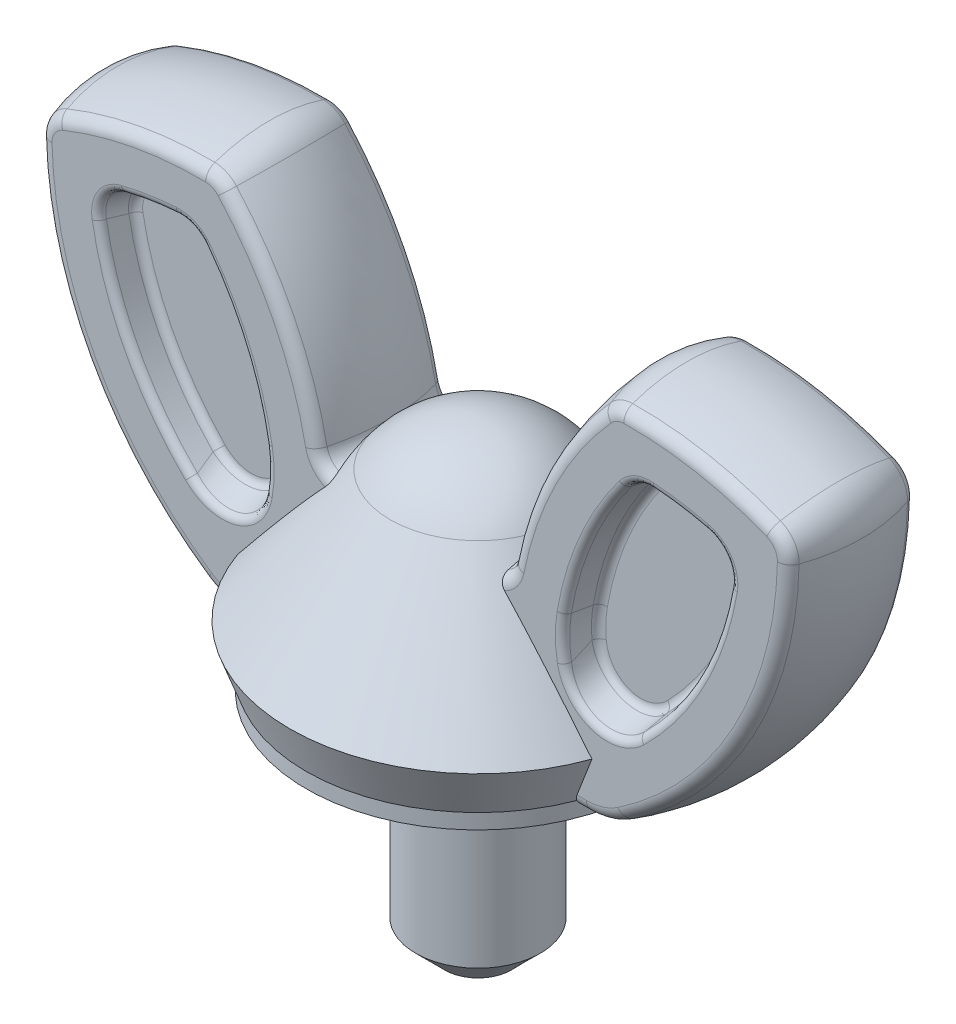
SolidWorks part; units mm, degrees
ref_plane "Front Plane" through (0, 0, 0) normal (0, 0, 1) x (1, 0, 0)
ref_plane "Top Plane" through (0, 0, 0) normal (0, 1, 0) x (1, 0, 0)
ref_plane "Right Plane" through (0, 0, 0) normal (1, 0, 0) x (0, 0, -1)
other "Configuration Table"
sketch "Sketch1" plane through (0, 0, 0) normal (0, 0, 1) x (1, 0, 0)
  line L0 (0, 10.7344) -> (0, 0) construction
  line L5 (4.826, 0) -> (-4.826, 0)
  line L6 (2.413, 5.08) -> (-2.413, 5.08)
  arc A11 (-2.413, 5.08) -> (-5.3975, 10.9034) centre (-13.1787, 3.2391) ccw
  arc A13 (-5.3975, 10.9034) -> (-10.795, 9.8298) centre (-6.0342, 0) ccw
  arc A24 (-10.795, 9.8298) -> (-6.0486, 0.3742) centre (0, 9.3295) ccw
  arc A26 (-4.826, 0) -> (-6.0486, 0.3742) centre (-4.826, 2.1844) cw
  arc A29 (4.826, 0) -> (6.0486, 0.3742) centre (4.826, 2.1844) ccw
  arc A34 (10.795, 9.8298) -> (6.0486, 0.3742) centre (0, 9.3295) cw
  arc A36 (5.3975, 10.9034) -> (10.795, 9.8298) centre (6.0342, 0) cw
  arc A37 (2.413, 5.08) -> (5.3975, 10.9034) centre (13.1787, 3.2391) cw
  point P19 (0, 0)
  point P27 (0, 5.08)
  point P29 (0, 5.08)
  point P44 (0, 5.08)
extrude "Extrude1" add sketch "Sketch1" along normal mid plane 3.556
fillet "Fillet4" radius 1.0922 4 edges at (10.795, 9.8298, 0) (5.3975, 10.9034, 0) (-5.3975, 10.9034, 0) (-10.795, 9.8298, 0)
sketch "Sketch2" plane through (0, 0, 1.778) normal (0, 0, 1) x (1, 0, 0)
  line L0 (0, 0) -> (0, 12.8329) construction
  line L1 (-4.826, 0) -> (4.826, 0) construction
  arc A10 (-4.1864, 4.7767) -> (-5.0416, 1.8652) centre (-7.5893, 4.1949) cw
  arc A11 (4.1864, 4.7767) -> (6.2055, 9.1212) centre (13.1787, 3.2391) cw
  arc A12 (6.2055, 9.1212) -> (8.9805, 8.634) centre (6.0342, 0) cw
  arc A13 (8.9805, 8.634) -> (5.0416, 1.8652) centre (0, 9.3295) cw
  arc A14 (4.1864, 4.7767) -> (5.0416, 1.8652) centre (7.5893, 4.1949) ccw
  arc A15 (-8.9805, 8.634) -> (-5.0416, 1.8652) centre (0, 9.3295) ccw
  arc A16 (-6.2055, 9.1212) -> (-8.9805, 8.634) centre (-6.0342, 0) ccw
  arc A17 (-4.1864, 4.7767) -> (-6.2055, 9.1212) centre (-13.1787, 3.2391) ccw
  arc A18 (-8.9805, 8.634) -> (-5.0416, 1.8652) centre (0, 9.3295) ccw
  arc A19 (-6.2055, 9.1212) -> (-8.9805, 8.634) centre (-6.0342, 0) ccw
  arc A20 (-4.1864, 4.7767) -> (-6.2055, 9.1212) centre (-13.1787, 3.2391) ccw
extrude "Cut-Extrude1" cut sketch "Sketch2" against normal blind 0.889 draft 10
fillet "Fillet1" radius 0.889 4 edges
fillet "Fillet6" radius 1.2446 2 edges
fillet "Fillet5" radius 0.3641 2 edges at (2.413, 5.08, 0) (-2.413, 5.08, 0)
fillet "Fillet3" radius 0.2223 28 edges at (7.4585, 9.011, 1.778) (7.4007, 8.8613, 0.889) (6.4621, 8.9114, 0.889) (8.6146, 8.3041, 0.889) (7.8855, 5.3103, 0.889) (4.2988, 4.3764, 0.889) (6.1282, 8.9579, 1.778) (8.7221, 8.5339, 1.778) (7.9776, 5.1471, 1.778) (4.1377, 4.1292, 1.778) (-4.2988, 4.3764, 0.889) (-7.8855, 5.3103, 0.889) (-8.5332, 8.4279, 0.889) (-7.4007, 8.8613, 0.889) (-6.1942, 8.7899, 0.889) (-4.1377, 4.1292, 1.778) (-7.9776, 5.1471, 1.778) (-8.7866, 8.4358, 1.778) (-7.4585, 9.011, 1.778) (-6.3795, 9.0717, 1.778) (4.9351, 6.7652, 0.889) (4.81, 6.8709, 1.778) (-4.9351, 6.7652, 0.889) (-4.81, 6.8709, 1.778) (4.9742, 2.938, 0.889) (5.0791, 2.5366, 1.778) (-5.2102, 2.8514, 0.889) (-5.0131, 2.5568, 1.778)
mirror "Mirror1" about plane through (0, 0, 0) normal (0, 0, 1) of "Fillet6", "Fillet3", "Fillet1", "Cut-Extrude1"
sketch "Sketch4" plane through (0, 0, 0) normal (1, 0, 0) x (0, 0, -1)
  line L1 (-1.778, 5.334) -> (1.778, 5.334)
  line L2 (-1.778, 4.4704) -> (-1.778, 5.334)
  line L4 (1.778, 0.3742) -> (1.778, 9.0918) construction
  line L6 (-1.778, 9.0918) -> (-1.778, 0.3742) construction
  line L7 (0, 5.715) -> (0, 0.381) construction
  line L9 (1.778, 4.4704) -> (1.778, 5.334)
  line L10 (-1.778, 5.08) -> (1.778, 5.08) construction
  arc A0 (-1.524, 4.826) -> (-1.778, 4.4704) centre (-1.4021, 4.4704) ccw
  arc A1 (1.524, 4.826) -> (-1.524, 4.826) centre (0, 0.381) ccw
  arc A2 (1.524, 4.826) -> (1.778, 4.4704) centre (1.4021, 4.4704) cw
  point P8 (0, 5.08)
sketch3d "3DSketch1"
  line L2 (-2.1102, 5.08, 1.778) -> (2.1102, 5.08, 1.778)
  line L3 (4.826, 0, 1.778) -> (-4.826, 0, 1.778)
  line L4 (-2.1102, 5.08, 1.778) -> (2.1102, 5.08, 1.778)
  line L5 (4.826, 0, 1.778) -> (-4.826, 0, 1.778)
  arc A15 (10.804, 9.0918, 1.778) -> (6.0486, 0.3742, 1.778) centre (0, 9.3295, 1.778) ccw
  arc A16 (10.1207, 10.1287, 1.778) -> (10.804, 9.0918, 1.778) centre (9.712, 9.1158, 1.778) ccw
  arc A17 (5.8682, 10.9207, 1.778) -> (10.1207, 10.1287, 1.778) centre (6.0342, 0, 1.778) ccw
  arc A18 (5.0743, 10.5608, 1.778) -> (5.8682, 10.9207, 1.778) centre (5.8848, 9.8287, 1.778) ccw
  arc A19 (2.4672, 5.3729, 1.778) -> (5.0743, 10.5608, 1.778) centre (13.1787, 3.2391, 1.778) ccw
  arc A20 (2.1102, 5.08, 1.778) -> (2.4672, 5.3729, 1.778) centre (2.1102, 5.4441, 1.778) ccw
  arc A21 (2.1102, 5.08, 1.778) -> (2.4672, 5.3729, 1.778) centre (2.1102, 5.4441, 1.778) ccw
  arc A22 (-5.0743, 10.5608, 1.778) -> (-2.4672, 5.3729, 1.778) centre (-13.1787, 3.2391, 1.778) ccw
  arc A23 (-5.8682, 10.9207, 1.778) -> (-5.0743, 10.5608, 1.778) centre (-5.8848, 9.8287, 1.778) ccw
  arc A24 (-10.1207, 10.1287, 1.778) -> (-5.8682, 10.9207, 1.778) centre (-6.0342, 0, 1.778) ccw
  arc A25 (-10.804, 9.0918, 1.778) -> (-10.1207, 10.1287, 1.778) centre (-9.712, 9.1158, 1.778) ccw
  arc A26 (-6.0486, 0.3742, 1.778) -> (-10.804, 9.0918, 1.778) centre (0, 9.3295, 1.778) ccw
  arc A27 (-4.826, 0, 1.778) -> (-6.0486, 0.3742, 1.778) centre (-4.826, 2.1844, 1.778) ccw
  arc A28 (6.0486, 0.3742, 1.778) -> (4.826, 0, 1.778) centre (4.826, 2.1844, 1.778) ccw
  arc A29 (10.804, 9.0918, 1.778) -> (6.0486, 0.3742, 1.778) centre (0, 9.3295, 1.778) ccw
  arc A30 (10.1207, 10.1287, 1.778) -> (10.804, 9.0918, 1.778) centre (9.712, 9.1158, 1.778) ccw
  arc A31 (5.8682, 10.9207, 1.778) -> (10.1207, 10.1287, 1.778) centre (6.0342, 0, 1.778) ccw
  arc A32 (5.0743, 10.5608, 1.778) -> (5.8682, 10.9207, 1.778) centre (5.8848, 9.8287, 1.778) ccw
  arc A33 (2.4672, 5.3729, 1.778) -> (5.0743, 10.5608, 1.778) centre (13.1787, 3.2391, 1.778) ccw
  arc A34 (-2.4672, 5.3729, 1.778) -> (-2.1102, 5.08, 1.778) centre (-2.1102, 5.4441, 1.778) ccw
  arc A35 (-2.4672, 5.3729, 1.778) -> (-2.1102, 5.08, 1.778) centre (-2.1102, 5.4441, 1.778) ccw
  arc A36 (-5.0743, 10.5608, 1.778) -> (-2.4672, 5.3729, 1.778) centre (-13.1787, 3.2391, 1.778) ccw
  arc A37 (-5.8682, 10.9207, 1.778) -> (-5.0743, 10.5608, 1.778) centre (-5.8848, 9.8287, 1.778) ccw
  arc A38 (-10.1207, 10.1287, 1.778) -> (-5.8682, 10.9207, 1.778) centre (-6.0342, 0, 1.778) ccw
  arc A39 (-10.804, 9.0918, 1.778) -> (-10.1207, 10.1287, 1.778) centre (-9.712, 9.1158, 1.778) ccw
  arc A40 (-6.0486, 0.3742, 1.778) -> (-10.804, 9.0918, 1.778) centre (0, 9.3295, 1.778) ccw
  arc A41 (-4.826, 0, 1.778) -> (-6.0486, 0.3742, 1.778) centre (-4.826, 2.1844, 1.778) ccw
  arc A42 (6.0486, 0.3742, 1.778) -> (4.826, 0, 1.778) centre (4.826, 2.1844, 1.778) ccw
  point P3 (2.1102, 5.4441, 2.1421)
  point P5 (2.1102, 5.4441, 2.1421)
  point P11 (-2.1102, 5.4441, 2.1421)
  point P13 (-2.1102, 5.4441, 2.1421)
  point P43 (0, 9.3295, -9.0286)
  point P46 (9.712, 9.1158, 0.6858)
  point P48 (6.0342, 0, -9.144)
  point P50 (5.8848, 9.8287, 0.6858)
  point P52 (13.1787, 3.2391, -9.144)
  point P58 (-13.1787, 3.2391, -9.144)
  point P60 (-5.8848, 9.8287, 0.6858)
  point P62 (-6.0342, 0, -9.144)
  point P64 (-9.712, 9.1158, 0.6858)
  point P66 (0, 9.3295, -9.0286)
  point P68 (-4.826, 2.1844, -0.4064)
  point P70 (4.826, 2.1844, -0.4064)
  point P71 (0, 9.3295, -9.0286)
  point P72 (9.712, 9.1158, 0.6858)
  point P73 (6.0342, 0, -9.144)
  point P74 (5.8848, 9.8287, 0.6858)
  point P75 (13.1787, 3.2391, -9.144)
  point P78 (-13.1787, 3.2391, -9.144)
  point P79 (-5.8848, 9.8287, 0.6858)
  point P80 (-6.0342, 0, -9.144)
  point P81 (-9.712, 9.1158, 0.6858)
  point P82 (0, 9.3295, -9.0286)
  point P83 (-4.826, 2.1844, -0.4064)
  point P84 (4.826, 2.1844, -0.4064)
  dimension "D1" = 0
sweep "Cut-Sweep2" cut profiles "Sketch4" path "3DSketch1"
sketch "Sketch3" plane through (0, 0, 0) normal (0, 0, 1) x (1, 0, 0)
  line L0 (0, 6.5903) -> (0, -11.3525) construction
  line L1 (1.7526, 0) -> (4.826, 0)
  line L2 (5.2882, 1.6933) -> (2.4672, 5.3729)
  line L4 (1.7526, 0) -> (1.7526, -6.35)
  line L5 (1.7526, -6.35) -> (0, -6.35)
  line L6 (4.826, 0) -> (4.826, 0.4233)
  line L7 (0, 6.5903) -> (0, -6.35)
  line L8 (0, 6.5903) -> (-2.4754, 6.5903) construction
  line L9 (4.826, 0.4233) -> (5.2882, 1.6933)
  arc A1 (2.4672, 5.3729) -> (0, 6.5903) centre (0, 3.4814) ccw
revolve "Revolve1" add sketch "Sketch3" angle 360 about L0
sketch "Sketch6" plane through (0, 0, 0) normal (0, 0, 1) x (1, 0, 0)
  line L0 (0, 4.5862) -> (0, -4.5862) construction
  line L3 (0.9398, -6.604) -> (1.778, -6.604)
  line L4 (1.778, -6.604) -> (1.778, -5.5118)
  line L5 (1.778, -5.5118) -> (0.9398, -6.35)
  line L6 (-1.7526, -6.35) -> (1.7526, -6.35) construction
  line L7 (1.7526, -6.35) -> (1.7526, 0) construction
  line L8 (0.9398, -6.35) -> (0.9398, -6.604)
  dimension "D1" = 45
  dimension "D3" = 0.254
  dimension "O" = 1.8796
  dimension "D5" = 0.0254
revolve "Cut-Revolve11" cut sketch "Sketch6" angle 360 about L0
sketch "Sketch5" plane through (0, 0, 0) normal (0, 0, 1) x (1, 0, 0)
  line L0 (1.7526, -0.0254) -> (1.2802, -0.2982)
  line L1 (1.2802, -0.2982) -> (1.7526, -0.5709)
  line L2 (1.7526, -0.5709) -> (1.7526, -0.0254)
  line L3 (0, 0) -> (0, -7.7715) construction
  line L6 (1.2802, -0.2982) -> (1.2802, -1.0906) construction
revolve "Cut-Revolve10" [suppressed] cut sketch "Sketch5" angle 360 about L3
pattern_linear "LPattern10" [suppressed] count 8 spacing 0.7925 along (0, -1, 0)
equation "\"D5@Sketch1\" = \"E@Sketch1\" / 2"
equation "\"D1@Sketch1\" = \"A@Sketch1\" / 4"
equation "\"D3@Sketch1\" = \"B@Sketch1\" * 9 /  10"
equation "\"D4@Sketch1\" = \"B@Sketch1\""
equation "\"D2@Sketch1\" = \"D4@Sketch1\" / 5"
equation "\"D1@Cut-Extrude1\" = \"C@Extrude1\" / 4"
equation "\"D1@Fillet1\" = \"D1@Cut-Extrude1\""
equation "\"D1@Fillet3\" = \"D1@Cut-Extrude1\" / 4"
equation "\"D2@Sketch3\" = \"G@Sketch1\" / 4"
equation "\"D3@Sketch3\" = \"E@Sketch1\""
equation "\"D1@Sketch4\" = \"C@Extrude1\" / 14"
equation "\"D1@Sketch5\" = \"d1@Sketch3\""
equation "\"D2@Sketch5\" = \"THD_MINOR@Cosmetic Thread1\""
equation "\"D3@LPattern10\" = \"pitch@Sketch5\""
equation "\"D1@LPattern10\" = \"L@Sketch3\" / \"D3@LPattern10\""
equation "\"D1@Cosmetic Thread1\" = \"L@Sketch3\""
equation "\"D2@Sketch4\" = \"D1@Sketch4\""
equation "\"D4@Sketch3\" = \"D2@Sketch3\" / 3"
equation "\"D1@Fillet4\" = \"D2@Sketch1\" /2"
equation "\"D1@Sketch2\" = \"D1@Sketch1\" / 3"
equation "\"D1@Fillet5\" = \"D1@Fillet4\" / 3"
equation "\"D1@Fillet6\" = \"D1@Fillet1\" * 1.4"
